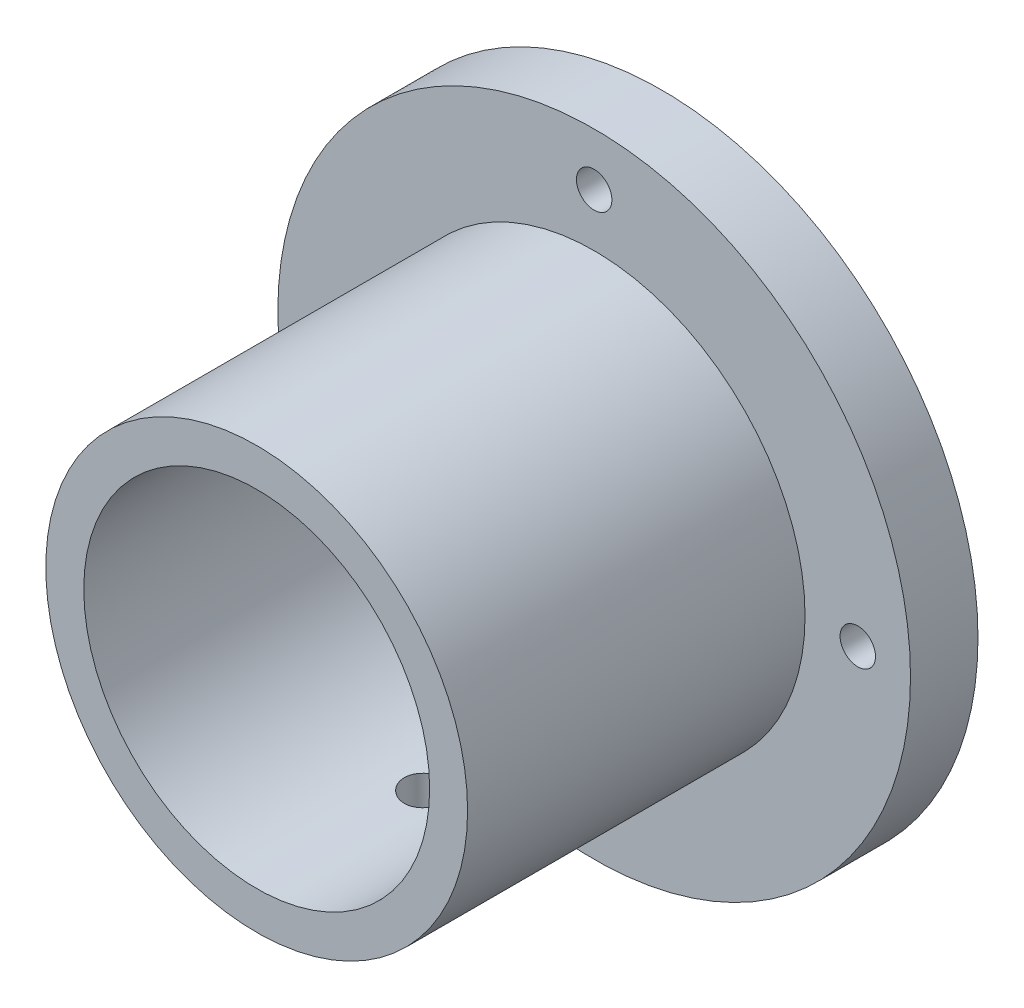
SolidWorks part; units mm, degrees
ref_plane "前视基准面" through (0, 0, 0) normal (0, 0, 1) x (1, 0, 0)
ref_plane "上视基准面" through (0, 0, 0) normal (0, 1, 0) x (1, 0, 0)
ref_plane "右视基准面" through (0, 0, 0) normal (1, 0, 0) x (0, 0, -1)
sketch "草图1" plane through (0, 0, 0) normal (0, 0, 1) x (1, 0, 0)
  circle A0 centre (0, 0) radius 37.5
  circle A1 centre (0, 31.25) radius 2.1
  circle A2 centre (-31.25, 0) radius 2.1
  circle A3 centre (0, -31.25) radius 2.1
  circle A4 centre (31.25, 0) radius 2.1
extrude "凸台-拉伸1" add sketch "草图1" along normal blind 8
sketch "草图2" plane through (0, 0, 8) normal (0, 0, 1) x (1, 0, 0)
  circle A0 centre (0, 0) radius 25
extrude "凸台-拉伸2" add sketch "草图2" along normal blind 40
sketch "草图3" plane through (0, 0, 48) normal (0, 0, 1) x (1, 0, 0)
  circle A0 centre (0, 0) radius 20.5
extrude "切除-拉伸1" cut sketch "草图3" against normal through all
ref_plane "基准面2" through (0, 10, 0) normal (0, 1, 0) x (-1, 0, 0)
sketch "草图4" plane through (0, 10, 0) normal (0, 1, 0) x (-1, 0, 0)
  line L0 (25, 48) -> (-25, 48) construction
  circle A0 centre (0, 28) radius 2.5
  dimension "D1" = 20
extrude "切除-拉伸2" cut sketch "草图4" against normal blind 40
